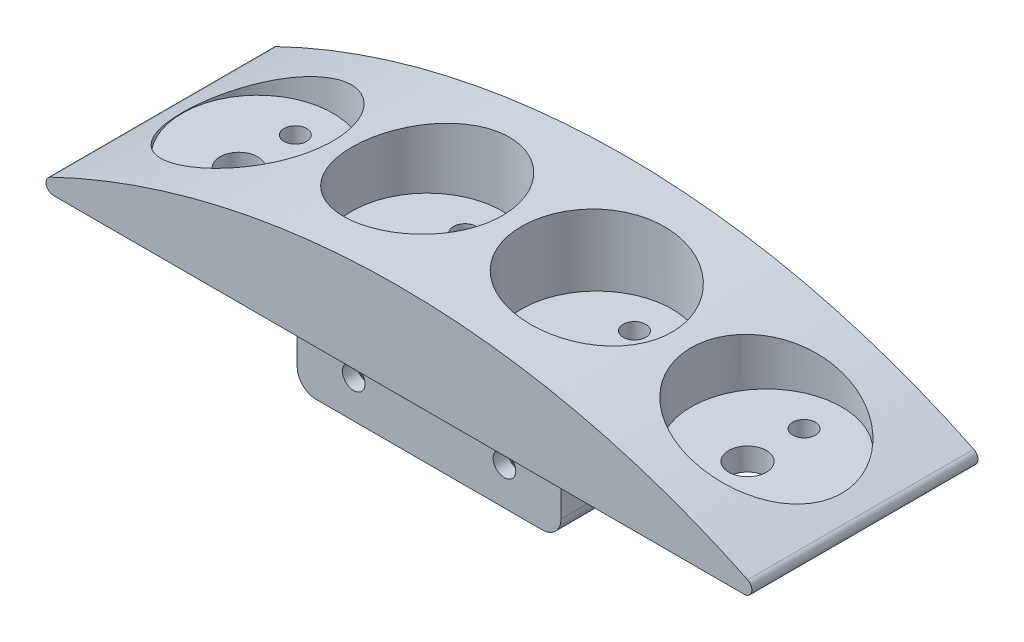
SolidWorks part; units mm, degrees
ref_plane "Alzado" through (0, 0, 0) normal (0, 0, 1) x (1, 0, 0)
ref_plane "Planta" through (0, 0, 0) normal (0, 1, 0) x (1, 0, 0)
ref_plane "Vista lateral" through (0, 0, 0) normal (1, 0, 0) x (0, 0, -1)
ref_plane "Plano1" through (0, 0, 52) normal (0, 0, 1) x (1, 0, 0)
sketch "Croquis1" plane through (0, 0, 52) normal (0, 0, 1) x (1, 0, 0)
  line L0 (0, 0) -> (200, 0)
  arc A0 (200, 0) -> (0, 0) centre (100, -187.5) ccw
extrude "Saliente-Extruir1" add sketch "Croquis1" against normal blind 52
sketch "Croquis2" plane through (0, 0, 0) normal (0, -1, 0) x (1, 0, 0)
  line L0 (135, 0) -> (65, 0)
  line L1 (65, 0) -> (65, 11.5)
  line L2 (65, 11.5) -> (135, 11.5)
  line L3 (135, 11.5) -> (135, 0)
  line L4 (0, 0) -> (200, 0) construction
  point P4 (100, 0)
  point P7 (100, 0)
  dimension "D1" = 70
extrude "Saliente-Extruir2" add sketch "Croquis2" along normal blind 20
sketch "Croquis3" plane through (0, 0, 0) normal (0, -1, 0) x (1, 0, 0)
  line L0 (135, 52) -> (135, 42)
  line L1 (135, 42) -> (65, 42)
  line L2 (65, 42) -> (65, 52)
  line L3 (65, 52) -> (135, 52)
  line L4 (65, 11.5) -> (65, 0) construction
  line L5 (135, 0) -> (135, 11.5) construction
extrude "Saliente-Extruir3" add sketch "Croquis3" along normal blind 20
sketch "Croquis6" plane through (0, 0, 52) normal (0, 0, 1) x (1, 0, 0)
  line L0 (200, 0) -> (0, 0)
  arc A0 (0, 0) -> (200, 0) centre (100, -187.5) cw
extrude "Saliente-Extruir4" add sketch "Croquis6" along normal blind 8
ref_plane "Plano2" through (0, 19.6232, 0) normal (0, 1, 0) x (1, 0, 0)
hole_wizard "Perforador para roscar Helicoil de M392" positions "Croquis10" profile "Croquis9" hole size "M39x3.0" standard "Ansi Metric"
sketch "Croquis10" plane through (0, 19.6232, 0) normal (0, 1, 0) x (1, 0, 0)
  point P0 (167.5, -30)
  point P1 (32.5, -30)
sketch "Croquis9" plane through (167.5, 19.6232, 30) normal (1, 0, 0) x (0, 0, 1)
  line L0 (0, 0) -> (0, 13.6232)
  line L1 (0, 13.6232) -> (20, 13.6232)
  line L2 (20, 13.6232) -> (20, 0)
  line L5 (20, 0) -> (0, 0)
  line L10 (0, 13.6232) -> (-20, 13.6232) construction
  line L11 (0, -6.35) -> (0, 107.95) construction
  dimension "Diámetro de taladro" = 40
  dimension "Profundidad de taladro" = 13.6232
  dimension "Ángulo de perforador" = 180
hole_wizard "Diámetro de taladro Ø10.0 (10)1" positions "Croquis12" profile "Croquis11" hole size "Ø10.0" standard "Ansi Metric"
sketch "Croquis12" plane through (0, 6, 0) normal (0, 1, 0) x (1, 0, 0)
  point P0 (167.5, -35)
  point P1 (32.5, -35)
  point P2 (77.5, -35)
  point P4 (122.5, -35)
  point P7 (0, 0)
  point P8 (0, 0)
  dimension "D1" = 135
  dimension "D2" = 45
  dimension "D3" = 45
sketch "Croquis11" plane through (167.5, 6, 35) normal (1, 0, 0) x (0, 0, 1)
  line L0 (0, 0) -> (0, 26)
  line L1 (0, 26) -> (5, 26)
  line L2 (5, 26) -> (5, 0)
  line L5 (5, 0) -> (0, 0)
  line L11 (0, -6.35) -> (0, 107.95) construction
  dimension "Diámetro de taladro hasta el siguiente" = 10
  dimension "Profundidad de taladro hasta el siguiente" = 26
hole_wizard "Diámetro de taladro Ø6.0 (6)2" positions "Croquis14" profile "Croquis13" hole size "Ø6.0" standard "Ansi Metric"
sketch "Croquis14" plane through (0, 0, 0) normal (0, -1, 0) x (-1, 0, 0)
  point P0 (-167.5, -20)
  point P1 (-32.5, -20)
  point P2 (-122.5, -20)
  point P4 (-77.5, -20)
  dimension "D1" = 135
  dimension "D2" = 45
  dimension "D3" = 45
sketch "Croquis13" plane through (167.5, 0, 20) normal (1, 0, 0) x (0, 0, -1)
  line L0 (0, 0) -> (0, 25)
  line L1 (0, 25) -> (3, 25)
  line L2 (3, 25) -> (3, 0)
  line L5 (3, 0) -> (0, 0)
  line L11 (0, -6.35) -> (0, 107.95) construction
  dimension "Diámetro de taladro hasta el siguiente" = 6
  dimension "Profundidad de taladro hasta el siguiente" = 25
hole_wizard "Taladro1" positions "Croquis16" profile "Croquis15" legacy
sketch "Croquis16" plane through (0, 0, 11.5) normal (0, 0, 1) x (1, 0, 0)
  line L0 (135, -20) -> (65, -20) construction
  point P0 (80, -10)
  point P1 (120, -10)
  point P4 (100, -20)
  dimension "D1" = 40
  dimension "D2" = 20
sketch "Croquis15" plane through (80, -10, 11.5) normal (1, 0, 0) x (0, -1, 0)
  line L0 (0, 0) -> (0, 11.5)
  line L1 (0, 11.5) -> (3, 11.5)
  line L2 (3, 11.5) -> (3, 2.8)
  line L3 (3, 2.8) -> (4, 1.8)
  line L4 (4, 1.8) -> (4, 0)
  line L5 (4, 0) -> (0, 0)
  line L6 (0, -6.13) -> (0, 109.2824) construction
  line L7 (-3, 2.8) -> (-4, 1.8) construction
  line L8 (0, 11.5) -> (-3, 11.5) construction
  dimension "Diámetro" = 6
  dimension "Profundidad" = 11.5
  dimension "Diámetro de perforado hasta intermedio" = 8
  dimension "Profundidad de perforado hasta intermedio" = 1.8
  dimension "Ángulo de perforado hasta intermedio" = 90
hole_wizard "Taladro2" positions "Croquis18" profile "Croquis17" legacy
sketch "Croquis18" plane through (0, 0, 42) normal (0, 0, -1) x (-1, 0, 0)
  point P0 (-120, -10)
  point P1 (-80, -10)
  point P4 (0, 0)
sketch "Croquis17" plane through (120, -10, 42) normal (1, 0, 0) x (0, 1, 0)
  line L0 (0, 0) -> (0, 18)
  line L1 (0, 18) -> (3, 18)
  line L2 (3, 18) -> (3, 6.3)
  line L3 (3, 6.3) -> (4, 5.3)
  line L4 (4, 5.3) -> (4, 0)
  line L5 (4, 0) -> (0, 0)
  line L6 (0, -6.13) -> (0, 109.2824) construction
  line L7 (-3, 6.3) -> (-4, 5.3) construction
  line L8 (0, 18) -> (-3, 18) construction
  dimension "Diámetro" = 6
  dimension "Profundidad" = 18
  dimension "Diámetro de perforado hasta intermedio" = 8
  dimension "Profundidad de perforado hasta intermedio" = 5.3
  dimension "Ángulo de perforado hasta intermedio" = 90
ref_plane "Plano3" through (0, 24.9853, 0) normal (0, 1, 0) x (1, 0, 0)
hole_wizard "Perforador para roscar Helicoil de M392" positions "Croquis20" profile "Croquis19" hole size "M39x3.0" standard "Ansi Metric"
sketch "Croquis20" plane through (0, 24.9853, 0) normal (0, 1, 0) x (1, 0, 0)
  point P0 (77.5, -30)
  point P1 (122.5, -30)
sketch "Croquis19" plane through (77.5, 24.9853, 30) normal (1, 0, 0) x (0, 0, 1)
  line L0 (0, 0) -> (0, 18.99)
  line L1 (0, 18.99) -> (20, 18.99)
  line L2 (20, 18.99) -> (20, 0)
  line L5 (20, 0) -> (0, 0)
  line L10 (0, 18.99) -> (-20, 18.99) construction
  line L11 (0, -6.35) -> (0, 107.95) construction
  dimension "Diámetro de taladro" = 40
  dimension "Profundidad de taladro" = 18.99
  dimension "Ángulo de perforador" = 180
fillet "Redondeo1" radius 5 8 edges at (65, -20, 5.75) (65, 0, 5.75) (135, -20, 5.75) (135, 0, 5.75) (135, 0, 47) (135, -20, 47) (65, -20, 47) (65, 0, 47)
fillet "Redondeo2" radius 2 2 edges at (0, 0, 30) (200, 0, 30)
